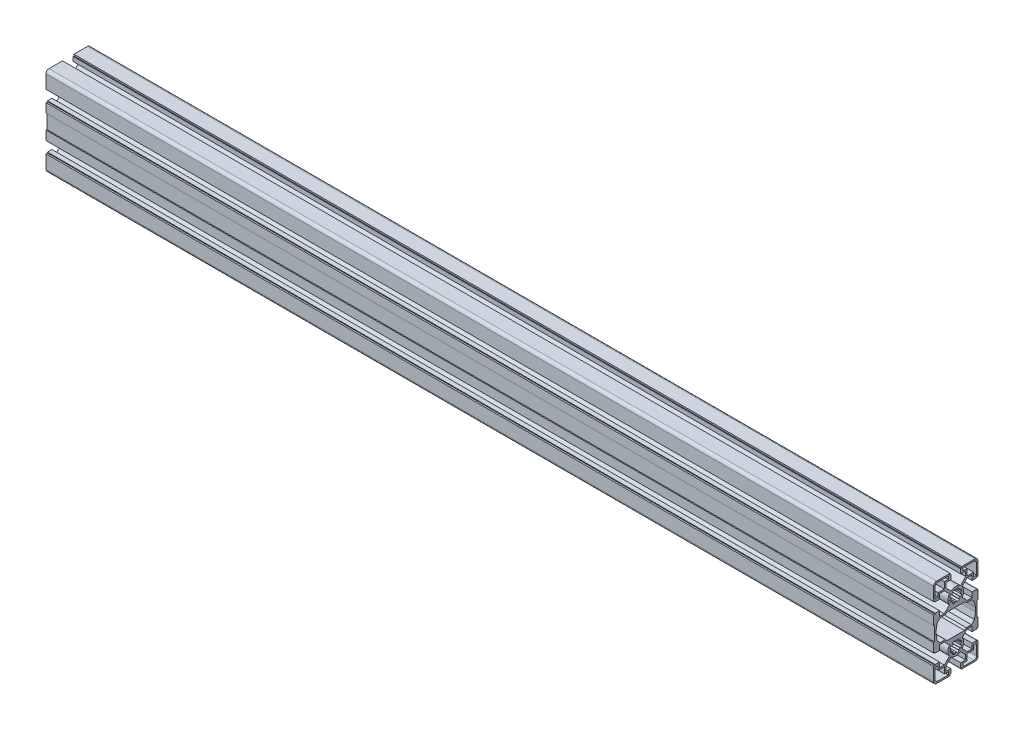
SolidWorks part; units mm, degrees
ref_plane "Plan de face" through (0, 0, 0) normal (0, 0, 1) x (1, 0, 0)
ref_plane "Plan de dessus" through (0, 0, 0) normal (0, 1, 0) x (1, 0, 0)
ref_plane "Plan de droite" through (0, 0, 0) normal (1, 0, 0) x (0, 0, -1)
sketch "Esquisse1" plane through (0, 0, 0) normal (1, 0, 0) x (0, 0, -1)
  point P0 (0, 0)
  line B0 (-7.5, 40.5) -> (-7.5, 43.5)
  line B1 (-11.55, 40.5) -> (-7.5, 40.5)
  line B2 (-11.55, 34.05) -> (-11.55, 40.5)
  line B3 (-18, 34.05) -> (-11.55, 34.05)
  line B4 (-18, 30) -> (-18, 34.05)
  line B5 (-21, 30) -> (-18, 30)
  line B6 (-21, 41) -> (-21, 30)
  line B7 (-7.5, 43.5) -> (-18.5, 43.5)
  line B8 (18.5, 43.5) -> (7.5, 43.5)
  line B9 (21, 30) -> (21, 41)
  line B10 (18, 30) -> (21, 30)
  line B11 (18, 34.05) -> (18, 30)
  line B12 (11.55, 34.05) -> (18, 34.05)
  line B13 (11.55, 40.5) -> (11.55, 34.05)
  line B14 (7.5, 40.5) -> (11.55, 40.5)
  line B15 (7.5, 43.5) -> (7.5, 40.5)
  line B16 (1.0593, 28.5073) -> (0.8682, 27.424)
  line B17 (2.8679, 26.5958) -> (3.4988, 27.4968)
  line B18 (4.924, 23.3682) -> (6.0073, 23.5593)
  line B19 (6.0073, 21.4407) -> (4.924, 21.6318)
  line B20 (4.0958, 19.6321) -> (4.9968, 19.0012)
  line B21 (3.4988, 17.5032) -> (2.8679, 18.4042)
  line B22 (-1.0593, 16.4927) -> (-0.8682, 17.576)
  line B23 (-2.8679, 18.4042) -> (-3.4988, 17.5032)
  line B24 (-4.9968, 19.0012) -> (-4.0958, 19.6321)
  line B25 (-4.924, 21.6318) -> (-6.0073, 21.4407)
  line B26 (-6.0073, 23.5593) -> (-4.924, 23.3682)
  line B27 (-4.0958, 25.3679) -> (-4.9968, 25.9988)
  line B28 (-3.4988, 27.4968) -> (-2.8679, 26.5958)
  line B29 (-0.8682, 27.424) -> (-1.0593, 28.5073)
  line B30 (4.9968, 25.9988) -> (4.0958, 25.3679)
  line B31 (10.6143, 10.95) -> (8.8929, 12.5)
  line B32 (15.8405, 10.95) -> (10.6143, 10.95)
  line B33 (18.8418, 7.9487) -> (15.8405, 10.95)
  line B34 (20, 1.8964) -> (18.8418, 7.9487)
  line B35 (20, -1.8964) -> (20, 1.8964)
  line B36 (18.8418, -7.9487) -> (20, -1.8964)
  line B37 (15.8405, -10.95) -> (18.8418, -7.9487)
  line B38 (10.6143, -10.95) -> (15.8405, -10.95)
  line B39 (-21, 27.5) -> (-16.5, 27.5)
  line B40 (-16.5, 27.5) -> (-16.5, 32.55)
  line B41 (-16.5, 32.55) -> (-11.7, 32.55)
  line B42 (-11.7, 32.55) -> (-6.4214, 27.2714)
  line B43 (-6.4214, 17.7286) -> (-11.7, 12.45)
  line B44 (-11.7, 12.45) -> (-16.5, 12.45)
  line B45 (-16.5, 12.45) -> (-16.5, 17.5)
  line B46 (-16.5, 17.5) -> (-21, 17.5)
  line B47 (-21, 17.5) -> (-21, 16.7)
  line B48 (-21, 16.7) -> (-22.5, 16.7)
  line B49 (-22.5, 16.7) -> (-22.5, 7.5)
  line B50 (-22.5, 7.5) -> (-21.5, 7.5)
  line B51 (-21.5, 7.5) -> (-21.5, -7.5)
  line B52 (-21.5, -7.5) -> (-22.5, -7.5)
  line B53 (-22.5, -7.5) -> (-22.5, -16.7)
  line B54 (-22.5, -16.7) -> (-21, -16.7)
  line B55 (-21, -16.7) -> (-21, -17.5)
  line B56 (-21, -17.5) -> (-16.5, -17.5)
  line B57 (-16.5, -17.5) -> (-16.5, -12.45)
  line B58 (-16.5, -12.45) -> (-11.7, -12.45)
  line B59 (-11.7, -12.45) -> (-6.4214, -17.7286)
  line B60 (-6.4214, -27.2714) -> (-11.7, -32.55)
  line B61 (-11.7, -32.55) -> (-16.5, -32.55)
  line B62 (-16.5, -32.55) -> (-16.5, -27.5)
  line B63 (-16.5, -27.5) -> (-21, -27.5)
  line B64 (-21, -27.5) -> (-21, -28.3)
  line B65 (-21, -28.3) -> (-22.5, -28.3)
  line B66 (-22.5, -28.3) -> (-22.5, -42)
  line B67 (-19.5, -45) -> (-5.8, -45)
  line B68 (-5.8, -45) -> (-5.8, -43.5)
  line B69 (-5.8, -43.5) -> (-5, -43.5)
  line B70 (-5, -43.5) -> (-5, -39)
  line B71 (-5, -39) -> (-10.05, -39)
  line B72 (-10.05, -39) -> (-10.05, -34.2)
  line B73 (-10.05, -34.2) -> (-4.7714, -28.9214)
  line B74 (4.7714, -28.9214) -> (10.05, -34.2)
  line B75 (10.05, -34.2) -> (10.05, -39)
  line B76 (10.05, -39) -> (5, -39)
  line B77 (5, -39) -> (5, -43.5)
  line B78 (5, -43.5) -> (5.8, -43.5)
  line B79 (5.8, -43.5) -> (5.8, -45)
  line B80 (5.8, -45) -> (19.5, -45)
  line B81 (22.5, -42) -> (22.5, -28.3)
  line B82 (22.5, -28.3) -> (21, -28.3)
  line B83 (21, -28.3) -> (21, -27.5)
  line B84 (21, -27.5) -> (16.5, -27.5)
  line B85 (16.5, -27.5) -> (16.5, -32.55)
  line B86 (16.5, -32.55) -> (11.7, -32.55)
  line B87 (11.7, -32.55) -> (6.4214, -27.2714)
  line B88 (6.4214, -17.7286) -> (11.7, -12.45)
  line B89 (11.7, -12.45) -> (16.5, -12.45)
  line B90 (16.5, -12.45) -> (16.5, -17.5)
  line B91 (16.5, -17.5) -> (21, -17.5)
  line B92 (21, -17.5) -> (21, -16.7)
  line B93 (21, -16.7) -> (22.5, -16.7)
  line B94 (22.5, -16.7) -> (22.5, -7.5)
  line B95 (22.5, -7.5) -> (21.5, -7.5)
  line B96 (21.5, -7.5) -> (21.5, 7.5)
  line B97 (21.5, 7.5) -> (22.5, 7.5)
  line B98 (22.5, 7.5) -> (22.5, 16.7)
  line B99 (22.5, 16.7) -> (21, 16.7)
  line B100 (21, 16.7) -> (21, 17.5)
  line B101 (21, 17.5) -> (16.5, 17.5)
  line B102 (16.5, 17.5) -> (16.5, 12.45)
  line B103 (16.5, 12.45) -> (11.7, 12.45)
  line B104 (11.7, 12.45) -> (6.4214, 17.7286)
  line B105 (6.4214, 27.2714) -> (11.7, 32.55)
  line B106 (11.7, 32.55) -> (16.5, 32.55)
  line B107 (16.5, 32.55) -> (16.5, 27.5)
  line B108 (16.5, 27.5) -> (21, 27.5)
  line B109 (21, 27.5) -> (21, 28.3)
  line B110 (21, 28.3) -> (22.5, 28.3)
  line B111 (22.5, 28.3) -> (22.5, 42)
  line B112 (19.5, 45) -> (5.8, 45)
  line B113 (5.8, 45) -> (5.8, 43.5)
  line B114 (5.8, 43.5) -> (5, 43.5)
  line B115 (5, 43.5) -> (5, 39)
  line B116 (5, 39) -> (10.05, 39)
  line B117 (10.05, 39) -> (10.05, 34.2)
  line B118 (10.05, 34.2) -> (4.7714, 28.9214)
  line B119 (-4.7714, 28.9214) -> (-10.05, 34.2)
  line B120 (-10.05, 34.2) -> (-10.05, 39)
  line B121 (-10.05, 39) -> (-5, 39)
  line B122 (-5, 39) -> (-5, 43.5)
  line B123 (-5, 43.5) -> (-5.8, 43.5)
  line B124 (-5.8, 43.5) -> (-5.8, 45)
  line B125 (-5.8, 45) -> (-19.5, 45)
  line B126 (-22.5, 42) -> (-22.5, 28.3)
  line B127 (-22.5, 28.3) -> (-21, 28.3)
  line B128 (-21, 28.3) -> (-21, 27.5)
  line B129 (8.8929, -12.5) -> (10.6143, -10.95)
  line B130 (-8.8929, -12.5) -> (8.8929, -12.5)
  line B131 (-10.6143, -10.95) -> (-8.8929, -12.5)
  line B132 (-15.8405, -10.95) -> (-10.6143, -10.95)
  line B133 (-18.8418, -7.9487) -> (-15.8405, -10.95)
  line B134 (-20, -1.8964) -> (-18.8418, -7.9487)
  line B135 (-20, 1.8964) -> (-20, -1.8964)
  line B136 (-18.8418, 7.9487) -> (-20, 1.8964)
  line B137 (-15.8405, 10.95) -> (-18.8418, 7.9487)
  line B138 (-10.6143, 10.95) -> (-15.8405, 10.95)
  line B139 (-8.8929, 12.5) -> (-10.6143, 10.95)
  line B140 (8.8929, 12.5) -> (-8.8929, 12.5)
  line B141 (-21, -30) -> (-21, -41)
  line B142 (-18.5, -43.5) -> (-7.5, -43.5)
  line B143 (-7.5, -40.5) -> (-11.55, -40.5)
  line B144 (-11.55, -40.5) -> (-11.55, -34.05)
  line B145 (-11.55, -34.05) -> (-18, -34.05)
  line B146 (-18, -34.05) -> (-18, -30)
  line B147 (-18, -30) -> (-21, -30)
  line B148 (-2.8679, -26.5958) -> (-3.4988, -27.4968)
  line B149 (-1.0593, -28.5073) -> (-0.8682, -27.424)
  line B150 (0.8682, -27.424) -> (1.0593, -28.5073)
  line B151 (3.4988, -27.4968) -> (2.8679, -26.5958)
  line B152 (4.0958, -25.3679) -> (4.9968, -25.9988)
  line B153 (6.0073, -23.5593) -> (4.924, -23.3682)
  line B154 (4.924, -21.6318) -> (6.0073, -21.4407)
  line B155 (4.9968, -19.0012) -> (4.0958, -19.6321)
  line B156 (2.8679, -18.4042) -> (3.4988, -17.5032)
  line B157 (1.0593, -16.4927) -> (0.8682, -17.576)
  line B158 (-0.8682, -17.576) -> (-1.0593, -16.4927)
  line B159 (-4.9968, -25.9988) -> (-4.0958, -25.3679)
  line B160 (-4.924, -23.3682) -> (-6.0073, -23.5593)
  line B161 (-6.0073, -21.4407) -> (-4.924, -21.6318)
  line B162 (-4.0958, -19.6321) -> (-4.9968, -19.0012)
  line B163 (-3.4988, -17.5032) -> (-2.8679, -18.4042)
  line B164 (21, -41) -> (21, -30)
  line B165 (7.5, -43.5) -> (18.5, -43.5)
  line B166 (7.5, -40.5) -> (7.5, -43.5)
  line B167 (11.55, -34.05) -> (11.55, -40.5)
  line B168 (18, -34.05) -> (11.55, -34.05)
  line B169 (18, -30) -> (18, -34.05)
  line B170 (21, -30) -> (18, -30)
  line B171 (11.55, -40.5) -> (7.5, -40.5)
  line B172 (-7.5, -43.5) -> (-7.5, -40.5)
  arc B173 (-18.5, 43.5) -> (-21, 41) centre (-18.5, 41) ccw
  arc B174 (21, 41) -> (18.5, 43.5) centre (18.5, 41) ccw
  arc B175 (-6.4214, 27.2714) -> (-6.4214, 17.7286) centre (0, 22.5) ccw
  arc B176 (-6.4214, -17.7286) -> (-6.4214, -27.2714) centre (0, -22.5) ccw
  arc B177 (-22.5, -42) -> (-19.5, -45) centre (-19.5, -42) ccw
  arc B178 (-4.7714, -28.9214) -> (4.7714, -28.9214) centre (0, -22.5) ccw
  arc B179 (19.5, -45) -> (22.5, -42) centre (19.5, -42) ccw
  arc B180 (6.4214, -27.2714) -> (6.4214, -17.7286) centre (0, -22.5) ccw
  arc B181 (6.4214, 17.7286) -> (6.4214, 27.2714) centre (0, 22.5) ccw
  arc B182 (22.5, 42) -> (19.5, 45) centre (19.5, 42) ccw
  arc B183 (4.7714, 28.9214) -> (-4.7714, 28.9214) centre (0, 22.5) ccw
  arc B184 (-19.5, 45) -> (-22.5, 42) centre (-19.5, 42) ccw
  arc B185 (0.8682, 27.424) -> (-0.8682, 27.424) centre (0, 22.5) ccw
  arc B186 (3.4988, 27.4968) -> (1.0593, 28.5073) centre (0, 22.5) ccw
  arc B187 (4.0958, 25.3679) -> (2.8679, 26.5958) centre (0, 22.5) ccw
  arc B188 (6.0073, 23.5593) -> (4.9968, 25.9988) centre (0, 22.5) ccw
  arc B189 (4.924, 21.6318) -> (4.924, 23.3682) centre (0, 22.5) ccw
  arc B190 (4.9968, 19.0012) -> (6.0073, 21.4407) centre (0, 22.5) ccw
  arc B191 (2.8679, 18.4042) -> (4.0958, 19.6321) centre (0, 22.5) ccw
  arc B192 (1.0593, 16.4927) -> (3.4988, 17.5032) centre (0, 22.5) ccw
  arc B193 (-0.8682, 17.576) -> (0.8682, 17.576) centre (0, 22.5) ccw
  arc B194 (-3.4988, 17.5032) -> (-1.0593, 16.4927) centre (0, 22.5) ccw
  arc B195 (-4.0958, 19.6321) -> (-2.8679, 18.4042) centre (0, 22.5) ccw
  arc B196 (-6.0073, 21.4407) -> (-4.9968, 19.0012) centre (0, 22.5) ccw
  arc B197 (-4.924, 23.3682) -> (-4.924, 21.6318) centre (0, 22.5) ccw
  arc B198 (-4.9968, 25.9988) -> (-6.0073, 23.5593) centre (0, 22.5) ccw
  arc B199 (-2.8679, 26.5958) -> (-4.0958, 25.3679) centre (0, 22.5) ccw
  arc B200 (-1.0593, 28.5073) -> (-3.4988, 27.4968) centre (0, 22.5) ccw
  arc B201 (-21, -41) -> (-18.5, -43.5) centre (-18.5, -41) ccw
  arc B202 (-3.4988, -27.4968) -> (-1.0593, -28.5073) centre (0, -22.5) ccw
  arc B203 (-0.8682, -27.424) -> (0.8682, -27.424) centre (0, -22.5) ccw
  arc B204 (1.0593, -28.5073) -> (3.4988, -27.4968) centre (0, -22.5) ccw
  arc B205 (2.8679, -26.5958) -> (4.0958, -25.3679) centre (0, -22.5) ccw
  arc B206 (4.9968, -25.9988) -> (6.0073, -23.5593) centre (0, -22.5) ccw
  arc B207 (4.924, -23.3682) -> (4.924, -21.6318) centre (0, -22.5) ccw
  arc B208 (6.0073, -21.4407) -> (4.9968, -19.0012) centre (0, -22.5) ccw
  arc B209 (4.0958, -19.6321) -> (2.8679, -18.4042) centre (0, -22.5) ccw
  arc B210 (3.4988, -17.5032) -> (1.0593, -16.4927) centre (0, -22.5) ccw
  arc B211 (0.8682, -17.576) -> (-0.8682, -17.576) centre (0, -22.5) ccw
  arc B212 (-4.0958, -25.3679) -> (-2.8679, -26.5958) centre (0, -22.5) ccw
  arc B213 (-6.0073, -23.5593) -> (-4.9968, -25.9988) centre (0, -22.5) ccw
  arc B214 (-4.924, -21.6318) -> (-4.924, -23.3682) centre (0, -22.5) ccw
  arc B215 (-4.9968, -19.0012) -> (-6.0073, -21.4407) centre (0, -22.5) ccw
  arc B216 (-2.8679, -18.4042) -> (-4.0958, -19.6321) centre (0, -22.5) ccw
  arc B217 (-1.0593, -16.4927) -> (-3.4988, -17.5032) centre (0, -22.5) ccw
  arc B218 (18.5, -43.5) -> (21, -41) centre (18.5, -41) ccw
  line B219 (0.8682, 17.576) -> (1.0593, 16.4927)
sketch_block_instance "Profilé alu-1"
sketch_block "Profilé alu"
extrude "Boss.-Extru.1" add sketch "Esquisse1" along normal mid plane 900
